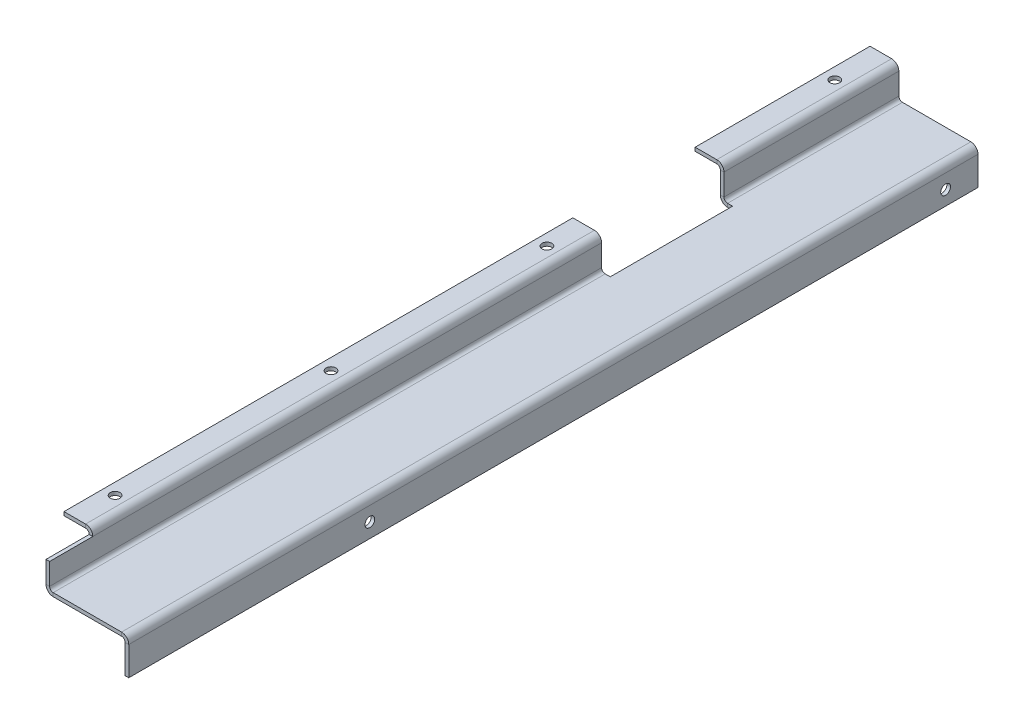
SolidWorks part; units mm, degrees
ref_plane "Plan de face" through (0, 0, 0) normal (0, 0, 1) x (1, 0, 0)
ref_plane "Plan de dessus" through (0, 0, 0) normal (0, 1, 0) x (1, 0, 0)
ref_plane "Plan de droite" through (0, 0, 0) normal (1, 0, 0) x (0, 0, -1)
mirrored part "CD033077_Rendre symétrique"
other "<CD033077>-<Dégagement M62>"
